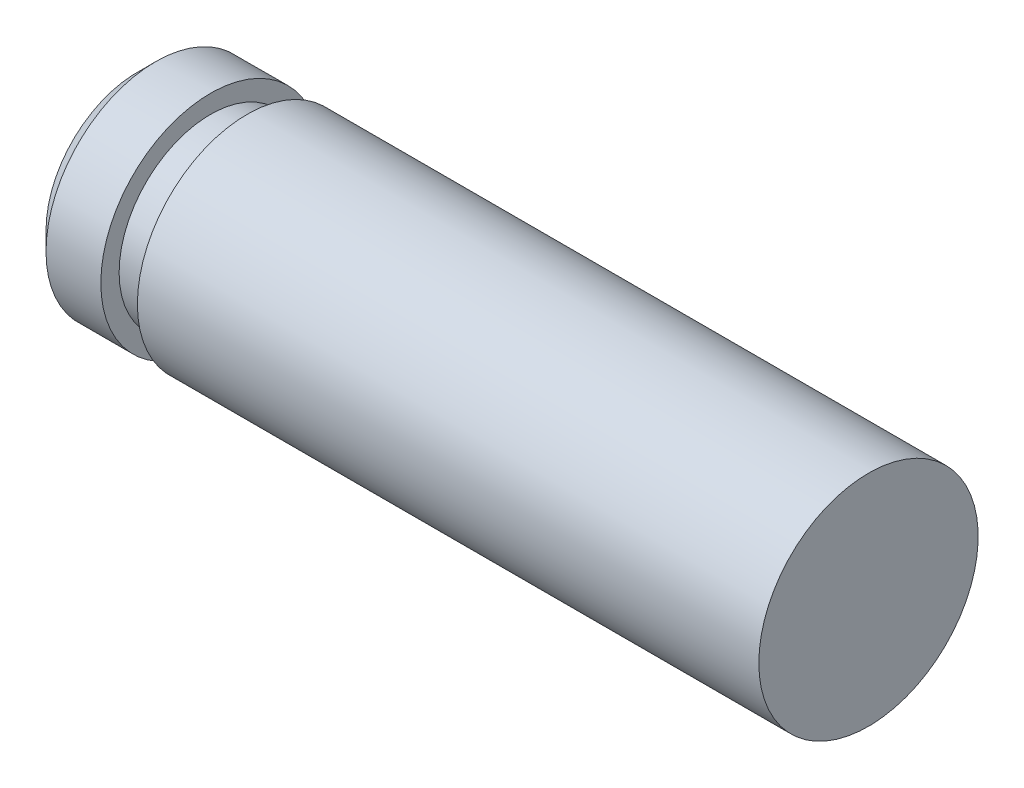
SolidWorks part; units mm, degrees
ref_plane "Plan de face" through (0, 0, 0) normal (0, 0, 1) x (1, 0, 0)
ref_plane "Plan de dessus" through (0, 0, 0) normal (0, 1, 0) x (1, 0, 0)
ref_plane "Plan de droite" through (0, 0, 0) normal (1, 0, 0) x (0, 0, -1)
sketch "Esquisse1" plane through (0, 0, 0) normal (0, 0, 1) x (1, 0, 0)
  line L0 (-29.0102, 0) -> (69.4449, 0) construction
  line L1 (0, 0) -> (0, 3)
  line L2 (0, 3) -> (2, 3)
  line L3 (2, 3) -> (2, 2.5)
  line L4 (2, 2.5) -> (3, 2.5)
  line L5 (3, 2.5) -> (3, 3)
  line L6 (3, 3) -> (20, 3)
  line L7 (20, 3) -> (20, 0)
  line L8 (20, 0) -> (0, 0)
  dimension "D1" = 3
  dimension "D2" = 3
  dimension "D3" = 2.5
  dimension "D4" = 1
  dimension "D5" = 2
  dimension "D6" = 20
revolve "Révolution1" add sketch "Esquisse1" angle 360 about L0
chamfer "Chanfrein1" distance 0.5 angle 45 1 edges at (0, 0, 3)
